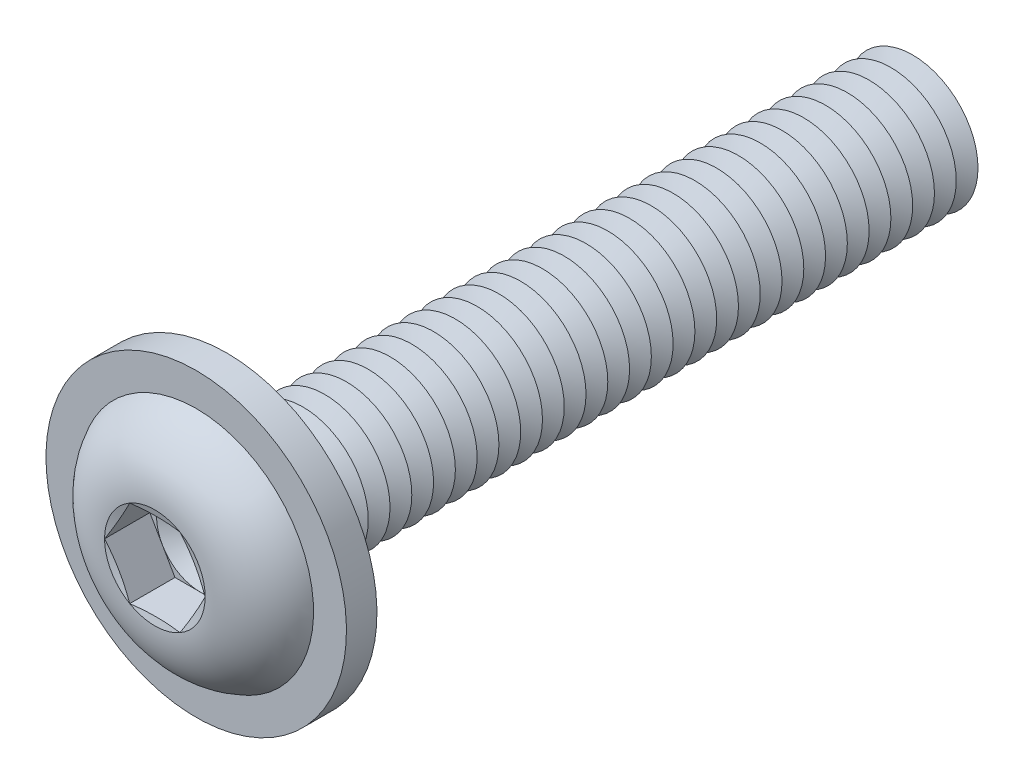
SolidWorks part; units mm, degrees
ref_plane "Front Plane" through (0, 0, 0) normal (0, 0, 1) x (1, 0, 0)
ref_plane "Top Plane" through (0, 0, 0) normal (0, 1, 0) x (1, 0, 0)
ref_plane "Right Plane" through (0, 0, 0) normal (1, 0, 0) x (0, 0, -1)
sketch "Sketch1" plane through (0, 0, 0) normal (1, 0, 0) x (0, 0, -1)
  line L0 (0, 1.5) -> (0, 2.85)
  line L3 (0, 1.5) -> (16, 1.5)
  line L4 (16, 1.5) -> (16, 0)
  line L5 (16, 0) -> (-1.65, 0) construction
  line L6 (-1.65, 0) -> (16, 0)
  line L7 (-1.65, 1.1547) -> (-1.65, 0.5773) construction
  line L8 (-1.65, 0.5773) -> (-1.65, 0)
  line L9 (-1.65, 1.1547) -> (-1.4953, 0.5773)
  line L10 (-1.4953, 0.5773) -> (-1.65, 0.5773)
  line L11 (16, 0) -> (22.7481, 0) construction
  line L12 (0, 2.85) -> (-1.65, 2.85) construction
  arc A1 (0, 2.85) -> (-1.65, 1.1547) centre (0, 1.1994) ccw
  point P8 (16, 0.75)
  dimension "D1" = 5.7
  dimension "D2" = 3
  dimension "D3" = 1.65
  dimension "D4" = 2.3094
  dimension "D5" = 16
  dimension "D6" = 15
revolve "Revolve1" add sketch "Sketch1" angle 360 about L5
fillet "Fillet1" radius 0.25 1 edges at (-1.5, 0, 0)
sketch "Sketch2" plane through (0, 0, 0) normal (1, 0, 0) x (0, 0, -1)
  line L0 (15.75, 1.5) -> (16.25, 1.5)
  line L1 (16, 1.5) -> (0.25, 1.5) construction
  line L2 (16.25, 1.5) -> (16, 1.067)
  line L3 (16, -1.5) -> (16, 1.5) construction
  line L4 (16, 1.067) -> (15.75, 1.5)
  dimension "D1" = 0.5
revolve "Cut-Revolve1" cut sketch "Sketch2" angle 360 about axis through (0, 0, -16) along (0, 0, -1)
pattern_linear "LPattern1" count 32 spacing 0.5 along (0, 0, 1) of "Cut-Revolve1"
sketch "Sketch3" plane through (0, 0, 1.65) normal (0, 0, 1) x (1, 0, 0)
  line L7 (0.5773, 1) -> (-0.5774, 1)
  line L8 (-0.5774, 1) -> (-1.1547, 0)
  line L9 (-1.1547, 0) -> (-0.5773, -1)
  line L10 (-0.5773, -1) -> (0.5773, -1)
  line L11 (0.5773, -1) -> (1.1547, 0)
  line L12 (1.1547, 0) -> (0.5773, 1)
  circle A0 centre (0, 0) radius 1 construction
  circle A3 centre (0, 0) radius 1.1547 construction
extrude "Cut-Extrude1" cut sketch "Sketch3" against normal blind 1.04
sketch "Sketch4" plane through (0, 0, 0.61) normal (0, 0, 1) x (1, 0, 0)
  line L1 (0.5773, 1) -> (-0.5774, 1) construction
  circle A0 centre (0, 0) radius 1
extrude "Cut-Extrude2" cut sketch "Sketch4" against normal through all draft 60
sketch "Sketch5" plane through (0, 0, 0) normal (0, 0, -1) x (-1, 0, 0)
  circle A0 centre (0, 0) radius 3.45
  circle A1 centre (0, 0) radius 1.75
  circle A2 centre (0, 0) radius 1.75 construction
  dimension "D1" = 6.9
extrude "Boss-Extrude1" add sketch "Sketch5" against normal blind 0.7
